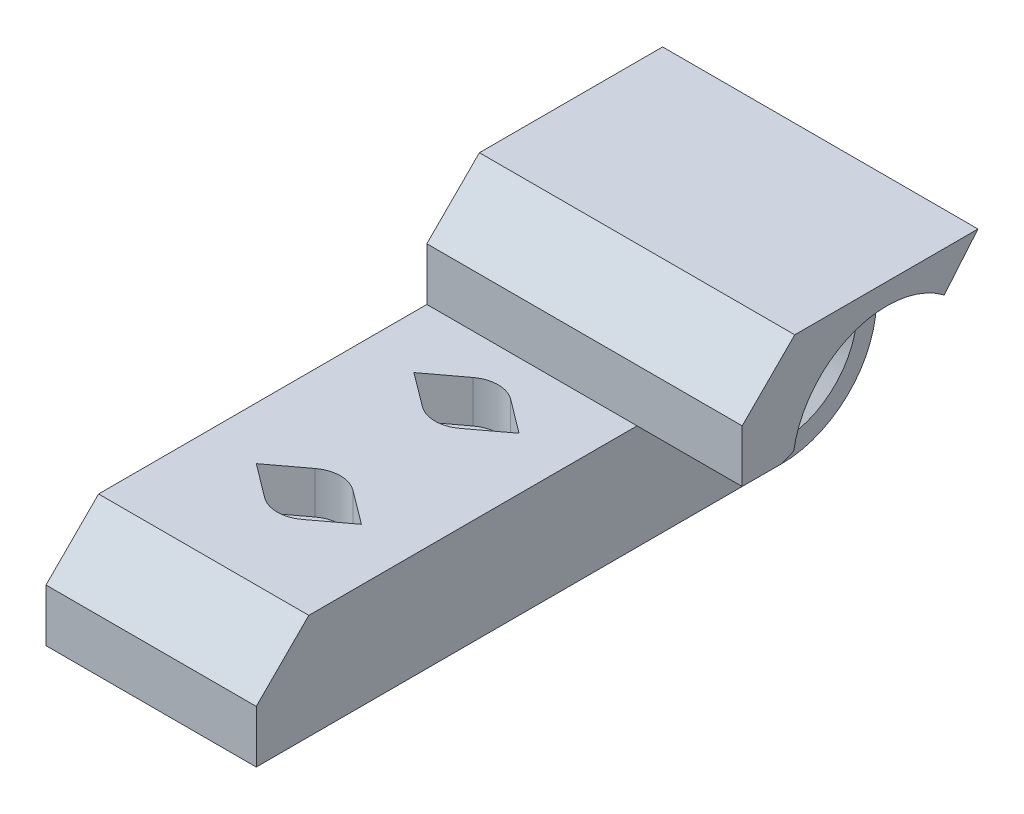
SolidWorks part; units mm, degrees
ref_plane "Front Plane" through (0, 0, 0) normal (0, 0, 1) x (1, 0, 0)
ref_plane "Top Plane" through (0, 0, 0) normal (0, 1, 0) x (1, 0, 0)
ref_plane "Right Plane" through (0, 0, 0) normal (1, 0, 0) x (0, 0, -1)
sketch "Sketch1" plane through (0, 0, 0) normal (1, 0, 0) x (0, 0, -1)
  line L0 (0, 0) -> (50, 0)
  line L1 (50, 0) -> (50, 18) construction
  line L2 (50, 18) -> (40, 18) construction
  line L3 (40, 18) -> (40, 10) construction
  line L4 (40, 10) -> (5, 10)
  line L5 (0, 5) -> (0, 0)
  line L6 (0, 5) -> (5, 10)
  line L7 (40, 10) -> (41.225, 7)
  arc A0 (50, 0) -> (41.225, 7) centre (50, 9) ccw
  dimension "D2" = 50
  dimension "D3" = 18
  dimension "D1" = 10
  dimension "D4" = 5
  dimension "D5" = 5
  dimension "D6" = 35
  dimension "D7" = 3
extrude "Boss-Extrude1" add sketch "Sketch1" against normal blind 20
sketch "Sketch2" plane through (0, 10, 0) normal (0, 1, 0) x (1, 0, 0)
  line L0 (0, 0) -> (-20, 0) construction
  line L1 (-10, 0) -> (-10, 30) construction
  circle A0 centre (-10, 30) radius 1.75
  circle A1 centre (-10, 15) radius 1.75
  dimension "D1" = 3.5
  dimension "D2" = 15
  dimension "D3" = 30
extrude "Cut-Extrude1" cut sketch "Sketch2" against normal up to next
sketch "Sketch3" plane through (0, 10, 0) normal (0, 1, 0) x (1, 0, 0)
  circle A0 centre (-10, 30) radius 3
  circle A1 centre (-10, 15) radius 3
  dimension "D1" = 6
extrude "Cut-Extrude2" cut sketch "Sketch3" against normal blind 4
sketch "Sketch4" [suppressed] plane through (-20, 0, 0) normal (-1, 0, 0) x (0, 0, 1)
  circle A0 centre (-50, 9) radius 6.15
  dimension "D1" = 12.3
extrude "Cut-Extrude3" [suppressed] cut sketch "Sketch4" against normal blind 13
chamfer "Chamfer1" [suppressed] distance 1 angle 45
sketch "Sketch5" plane through (0, 0, 0) normal (1, 0, 0) x (0, 0, -1)
  circle A0 centre (50, 9) radius 6.15
  dimension "D1" = 12.3
extrude "Cut-Extrude4" cut sketch "Sketch5" against normal blind 13
chamfer "Chamfer3" distance 1 angle 45 1 edges at (0, 9, -56.15)
sketch "Sketch6" [suppressed] plane through (0, 0, 0) normal (1, 0, 0) x (0, 0, -1)
  line L0 (0, 0) -> (59, 0) construction
  line L1 (59, 0) -> (59, 17.5575) construction
  line L2 (54.1968, 0) -> (72.0628, 21.2919) construction
  line L3 (36.225, 10) -> (36.225, 20.3247)
  line L4 (40, 10) -> (5, 10) construction
  line L5 (36.225, 20.3247) -> (58.1972, 20.3247)
  line L6 (58.1972, 20.3247) -> (54.9832, 16.4945)
  line L7 (40, 10) -> (36.225, 10)
  line L8 (41.225, 7) -> (40, 10) construction
  line L9 (41.225, 7) -> (40, 10)
  arc A0 (50, 0) -> (41.225, 7) centre (50, 9) ccw construction
  arc A2 (54.9832, 16.4945) -> (41.225, 7) centre (50, 9) ccw
  dimension "D1" = 10
  dimension "D2" = 130
  dimension "D3" = 5
  dimension "D4" = 5
extrude "Boss-Extrude2" [suppressed] add sketch "Sketch6" against normal blind 30
sketch "Sketch7" plane through (-20, 0, 0) normal (-1, 0, 0) x (0, 0, 1)
  line L0 (0, 0) -> (-59, 0) construction
  line L1 (-59, 0) -> (-59, 26.1179) construction
  line L2 (-54.1968, 0) -> (-62.4732, 9.8634) construction
  line L3 (-40, 10) -> (-5, 10) construction
  line L4 (-41.225, 7) -> (-40, 10) construction
  line L5 (-40, 10) -> (-36.225, 10)
  line L6 (-41.225, 7) -> (-40, 10)
  line L7 (-36.225, 10) -> (-36.225, 20)
  line L8 (-36.225, 20) -> (-58.654, 20)
  line L9 (-58.654, 20) -> (-55.4401, 16.1698)
  arc A0 (-41.225, 7) -> (-50, 0) centre (-50, 9) ccw construction
  arc A1 (-41.225, 7) -> (-55.4401, 16.1698) centre (-50, 9) ccw
  dimension "D1" = 130
  dimension "D2" = 5
  dimension "D3" = 10
  dimension "D4" = 5
extrude "Boss-Extrude3" add sketch "Sketch7" against normal blind 30
sketch "Sketch8" plane through (10, 0, 0) normal (1, 0, 0) x (0, 0, -1)
  line L0 (41.225, 7) -> (40, 10) construction
  line L1 (41.225, 7) -> (40, 10)
  line L2 (40, 10) -> (41.1187, 10.4568)
  arc A0 (55.4401, 16.1698) -> (41.225, 7) centre (50, 9) ccw construction
  arc A1 (41.1187, 10.4568) -> (41.225, 7) centre (50, 9) ccw
extrude "Cut-Extrude5" cut sketch "Sketch8" against normal up to surface (10 mm away)
sketch "Sketch9" [suppressed] plane through (-30, 0, 0) normal (-1, 0, 0) x (0, 0, 1)
  line L0 (-40, 10) -> (-41.225, 7) construction
  line L1 (-40, 10) -> (-41.225, 7)
  line L2 (-40, 10) -> (-41.1187, 10.4568)
  arc A0 (-41.225, 7) -> (-54.9832, 16.4945) centre (-50, 9) ccw construction
  arc A1 (-41.225, 7) -> (-41.1187, 10.4568) centre (-50, 9) ccw
extrude "Cut-Extrude6" [suppressed] cut sketch "Sketch9" against normal up to surface (10 mm away)
sketch "Sketch10" plane through (0, 10, 0) normal (0, 1, 0) x (1, 0, 0)
  line L0 (-10, 30) -> (-10, 15) construction
  line L1 (-10, 22.5) -> (-16.3344, 22.5) construction
  line L2 (-5, 30) -> (-15, 30) construction
  line L3 (-15, 30) -> (-11.8, 32.4)
  line L4 (-15, 30) -> (-11.8, 27.6)
  line L5 (-5, 30) -> (-8.2, 32.4)
  line L6 (-5, 30) -> (-8.2, 27.6)
  line L7 (-5, 15) -> (-8.2, 17.4)
  line L8 (-5, 15) -> (-8.2, 12.6)
  line L9 (-15, 15) -> (-11.8, 12.6)
  line L10 (-15, 15) -> (-11.8, 17.4)
  circle A0 centre (-10, 30) radius 3 construction
  circle A1 centre (-10, 30) radius 3 construction
  arc A2 (-11.8, 27.6) -> (-8.2, 27.6) centre (-10, 30) ccw
  arc A3 (-8.2, 32.4) -> (-11.8, 32.4) centre (-10, 30) ccw
  arc A4 (-11.8, 17.4) -> (-8.2, 17.4) centre (-10, 15) cw
  arc A5 (-8.2, 12.6) -> (-11.8, 12.6) centre (-10, 15) cw
  point P8 (-10, 30)
  dimension "D1" = 10
extrude "Cut-Extrude7" cut sketch "Sketch10" against normal up to surface (4 mm away)
chamfer "Chamfer4" [suppressed] distance 5 angle 45
chamfer "Chamfer5" distance 5 angle 45 1 edges at (-5, 20, -36.225)
